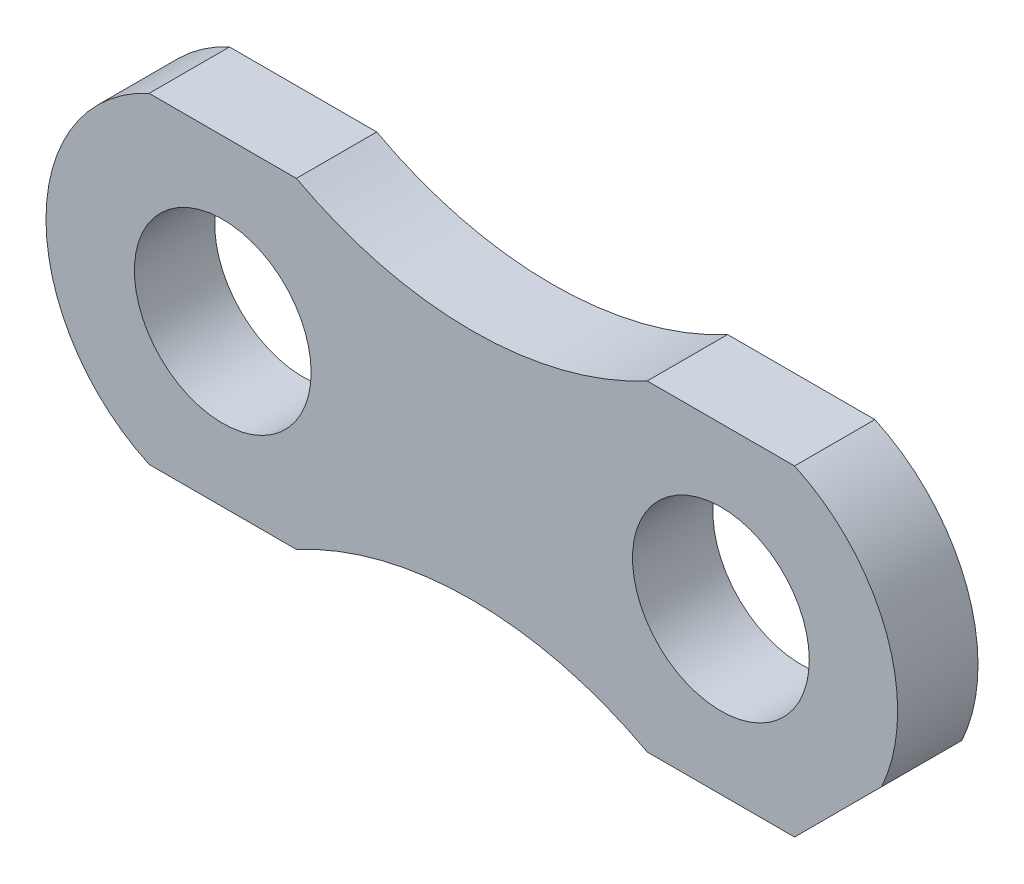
SolidWorks part; units mm, degrees
ref_plane "Plan de face" through (0, 0, 0) normal (0, 0, 1) x (1, 0, 0)
ref_plane "Plan de dessus" through (0, 0, 0) normal (0, 1, 0) x (1, 0, 0)
ref_plane "Plan de droite" through (0, 0, 0) normal (1, 0, 0) x (0, 0, -1)
sketch "Esquisse1" plane through (0, 0, 0) normal (0, 0, 1) x (1, 0, 0)
  line L0 (-9.1652, 20) -> (9.1652, 20)
  line L1 (-9.1652, -20) -> (9.1652, -20)
  line L2 (71.1652, -20) -> (82, -9.1652)
  line L3 (31, 26.6824) -> (31, -36.2374) construction
  line L4 (0, 0) -> (62, 0) construction
  line L5 (13.2897, 14.5) -> (48.3795, 14.5) construction
  line L6 (9.1652, -14.5) -> (52.8348, -14.5) construction
  line L7 (52.8348, -20) -> (71.1652, -20)
  line L8 (52.8348, 20) -> (71.1652, 20)
  circle A0 centre (0, 0) radius 11
  circle A1 centre (62, 0) radius 11
  arc A2 (-9.1652, 20) -> (-9.1652, -20) centre (0, 0) ccw
  arc A5 (82, -9.1652) -> (71.1652, 20) centre (62, 0) ccw
  arc A6 (9.1652, 20) -> (52.8348, 20) centre (31, 60.5919) ccw
  arc A7 (9.1652, -20) -> (52.8348, -20) centre (31, -60.5919) cw
  dimension "D1" = 22
  dimension "D2" = 22
  dimension "D5" = 44
  dimension "D3" = 62
  dimension "D4" = 20
  dimension "D6" = 20
  dimension "D8" = 45
  dimension "D9" = 31
  dimension "D10" = 14.5
  dimension "D11" = 14.5
extrude "Boss.-Extru.1" add sketch "Esquisse1" along normal blind 10
